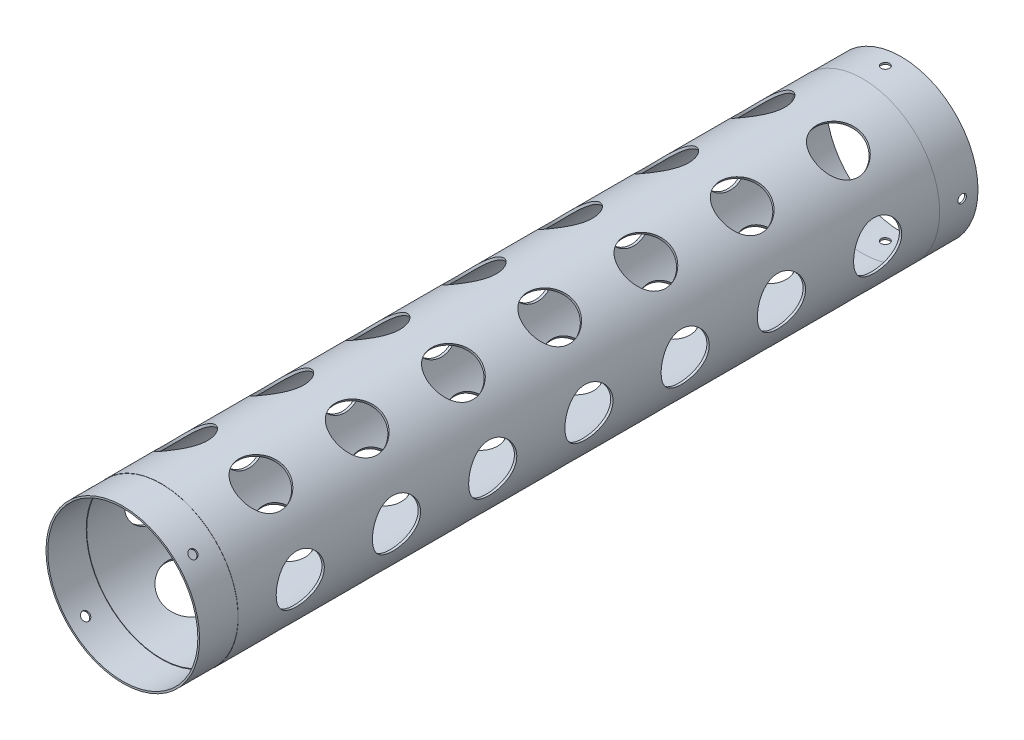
SolidWorks part; units mm, degrees
ref_plane "Front" through (0, 0, 0) normal (0, 0, 1) x (1, 0, 0)
ref_plane "Top" through (0, 0, 0) normal (0, 1, 0) x (1, 0, 0)
ref_plane "Right" through (0, 0, 0) normal (1, 0, 0) x (0, 0, -1)
sketch "Sketch1" plane through (0, 0, 0) normal (0, 0, 1) x (1, 0, 0)
  circle A0 centre (0, 0) radius 50.8
  circle A1 centre (0, 0) radius 49.2252
  dimension "D1" = 1.5748
  dimension "D2" = 101.6
extrude "Boss-Extrude1" add sketch "Sketch1" along normal blind 513.6083
sketch "Sketch2" plane through (0, 0, 0) normal (1, 0, 0) x (0, 0, -1)
  line L0 (-513.6083, 50.8) -> (-513.6083, -50.8) construction
  circle A0 centre (-447.3042, 0) radius 15.875
  dimension "D1" = 31.75
  dimension "D3" = 66.3042
extrude "Cut-Extrude1" cut sketch "Sketch2" along normal through all
pattern_circular "CirPattern1" count 6 over 360 about axis through (0, 0, 513.6083) along (0, 0, -1) of "Cut-Extrude1"
pattern_linear "LPattern1" count 7 spacing 63.5 along (0, 0, -1) of "CirPattern1", "Cut-Extrude1"
sketch "Sketch3" plane through (0, 0, 0) normal (1, 0, 0) x (0, 0, -1)
  line L0 (-513.6083, 50.8) -> (-513.6083, -50.8) construction
  line L1 (0, -50.8) -> (0, 50.8) construction
  circle A0 centre (-447.3042, 0) radius 15.875 construction
  circle A1 centre (-129.8042, 0) radius 15.875 construction
  circle A2 centre (-447.3042, 0) radius 15.875
  circle A3 centre (-129.8042, 0) radius 15.875
  dimension "D1" = 66.3042
  dimension "D2" = 129.8042
sketch "Sketch4" plane through (0, 0, 0) normal (1, 0, 0) x (0, 0, -1)
  line L0 (0, -50.8) -> (0, 50.8) construction
  line L1 (-25.4, 40.005) -> (6.35, 40.005)
  line L2 (-25.4, 40.005) -> (-25.4, 49.53)
  line L3 (-25.4, 49.53) -> (6.35, 49.53)
  line L4 (6.35, 40.005) -> (6.35, 49.53)
  line L5 (-513.6083, 0) -> (0, 0) construction
  line L6 (0, 0) -> (-59.1804, 0) construction
  line L7 (-256.8042, -50.8) -> (-256.8042, -81.4061) construction
  line L8 (-513.6083, -50.8) -> (0, -50.8) construction
  line L9 (-519.9583, 40.005) -> (-519.9583, 49.53)
  line L10 (-488.2083, 49.53) -> (-519.9583, 49.53)
  line L11 (-488.2083, 40.005) -> (-488.2083, 49.53)
  line L12 (-488.2083, 40.005) -> (-519.9583, 40.005)
  line L13 (-488.2083, 63.373) -> (-488.2083, 50.673)
  line L14 (-25.4, 63.373) -> (6.35, 63.373)
  line L15 (-25.4, 63.373) -> (-25.4, 50.673)
  line L16 (-25.4, 50.673) -> (6.35, 50.673)
  line L17 (6.35, 63.373) -> (6.35, 50.673)
  line L18 (-488.2083, 50.673) -> (-519.9583, 50.673)
  line L19 (-519.9583, 63.373) -> (-519.9583, 50.673)
  line L20 (-488.2083, 63.373) -> (-519.9583, 63.373)
  dimension "D1" = 25.4
  dimension "D2" = 31.75
  dimension "D3" = 99.06
  dimension "D4" = 9.525
  dimension "D5" = 101.346
  dimension "D6" = 12.7
revolve "Cut-Revolve1" cut sketch "Sketch4" angle 360 about L6
ref_plane "Plane1" through (0, 0, 0) normal (0.7071, -0.7071, 0) x (0, 0, -1)
sketch "Sketch5" plane through (0, 0, 0) normal (1, 0, 0) x (0, 0, -1)
  line L0 (-25.4, 0) -> (0, 0) construction
  line L1 (0, -50.673) -> (0, 50.673) construction
  line L2 (-256.8042, 50.8) -> (-256.8042, 74.7417) construction
  line L3 (-25.4, 50.8) -> (-488.2083, 50.8) construction
  line L4 (-256.8042, 43.9941) -> (-256.8042, 42.6303) construction
  circle A0 centre (-10.4775, 0) radius 2.794
  circle A1 centre (-10.4775, 0) radius 4.6355 construction
  circle A2 centre (-503.1308, 0) radius 2.794 construction
  dimension "D1" = 5.588
  dimension "D3" = 9.271
  dimension "D2" = 10.4775
  dimension "D4" = 5.842
extrude "Cut-Extrude2" cut sketch "Sketch5" against normal mid plane 127
pattern_circular "CirPattern2" count 2 every 90 about axis through (0, 0, 513.6083) along (0, 0, -1) of "Cut-Extrude2"
sketch "Sketch6" plane through (0, 0, 0) normal (0.7071, -0.7071, 0) x (0, 0, -1)
  line L2 (-256.8042, 50.8) -> (-256.8042, 74.7417) construction
  circle A0 centre (-10.4775, 0) radius 2.794 construction
  circle A1 centre (-10.4775, 0) radius 4.6355 construction
  circle A2 centre (-503.1308, 0) radius 2.794
  ellipse E0 centre (-10.4775, 0) end of major axis (-7.6835, 0) minor radius 1.9757 construction
  ellipse E1 centre (-503.1308, 0) end of major axis (-505.9248, 0) minor radius 1.9757 construction
  dimension "D1" = 5.588
  dimension "D3" = 9.271
extrude "Cut-Extrude3" cut sketch "Sketch6" against normal through all and the other way through all
pattern_circular "CirPattern3" count 4 over 360 about axis through (0, 0, 513.6083) along (0, 0, -1) of "Cut-Extrude3"
ref_plane "Plane2" through (0, 0, 10.3187) normal (0, 0, 1) x (1, 0, 0)
ref_plane "Plane3" through (0, 0, 503.1308) normal (0, 0, 1) x (1, 0, 0)
